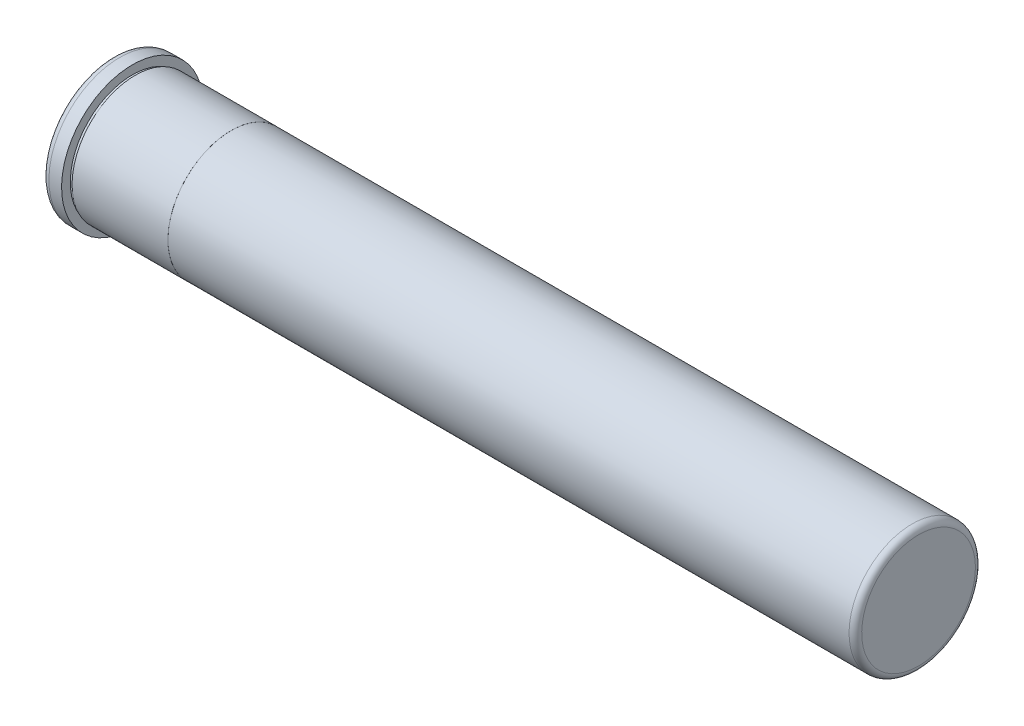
SolidWorks part; units mm, degrees
ref_plane "Front Plane" through (0, 0, 0) normal (0, 0, 1) x (1, 0, 0)
ref_plane "Top Plane" through (0, 0, 0) normal (0, 1, 0) x (1, 0, 0)
ref_plane "Right Plane" through (0, 0, 0) normal (1, 0, 0) x (0, 0, -1)
sketch "Sketch1" plane through (0, 0, 0) normal (0, 0, 1) x (1, 0, 0)
  line L0 (320.6623, 0) -> (-3.1877, 0) construction
  line L1 (-3.1877, 0) -> (-3.1877, 25.6032)
  line L2 (-0.3429, 28.448) -> (4.7498, 28.448)
  line L3 (4.7498, 28.448) -> (4.7498, 24.9472)
  line L4 (4.7498, 24.9472) -> (5.9315, 24.9472)
  line L5 (5.9315, 24.9472) -> (5.9315, 25.4127)
  line L6 (44.4373, 25.4127) -> (44.4373, 25.3873)
  line L7 (44.4373, 25.3873) -> (318.1223, 25.3873)
  line L8 (320.6623, 22.8473) -> (320.6623, 0)
  line L9 (320.6623, 0) -> (-3.1877, 0)
  line L10 (320.6623, 0) -> (117.4528, 0) construction
  line L11 (-3.1877, 0) -> (-10.1781, 0) construction
  line L12 (5.9315, 25.4127) -> (44.4373, 25.4127)
  arc A0 (318.1223, 25.3873) -> (320.6623, 22.8473) centre (318.1223, 22.8473) cw
  arc A1 (-0.3429, 28.448) -> (-3.1877, 25.6032) centre (-0.3429, 25.6032) ccw
  point P17 (-3.1877, 28.448)
  dimension "EndRad" = 2.54
  dimension "HeadRad" = 2.8448
  dimension "D1" = 0.4655
  dimension "HeadThickness" = 7.9375
  dimension "OverallLength" = 323.85
  dimension "HeadDia" = 56.896
  dimension "D4" = 1.1817
  dimension "PinDia" = 50.7746
  dimension "PFL" = 47.625
  dimension "PF" = 50.8254
revolve "Revolve1" add sketch "Sketch1" angle 360 about L0
